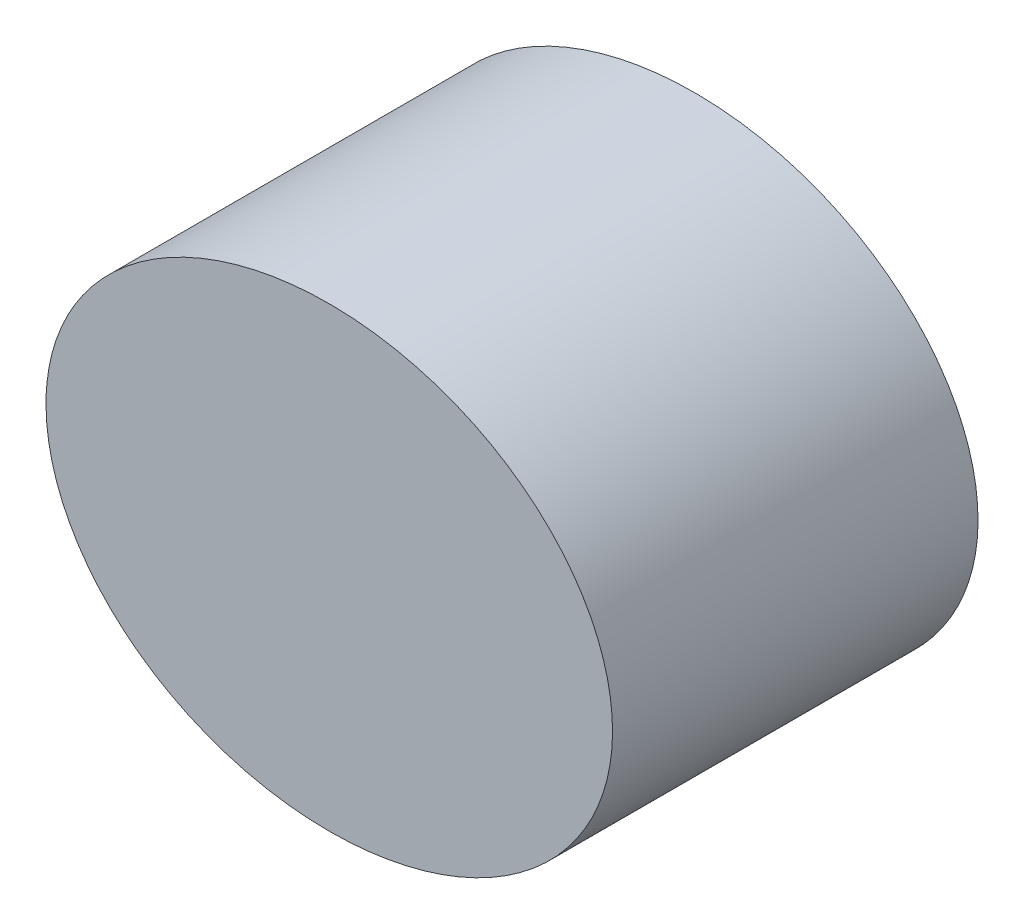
SolidWorks part; units mm, degrees
ref_plane "Front Plane" through (0, 0, 0) normal (0, 0, 1) x (1, 0, 0)
ref_plane "Top Plane" through (0, 0, 0) normal (0, 1, 0) x (1, 0, 0)
ref_plane "Right Plane" through (0, 0, 0) normal (1, 0, 0) x (0, 0, -1)
sketch "Sketch1" plane through (0, 0, 0) normal (0, 0, 1) x (1, 0, 0)
  ellipse E0 centre (0, 0) end of major axis (-15.5, 0) minor radius 12.5
ref_plane "Plane1" through (0, 0, 60) normal (0, 0, 1) x (1, 0, 0)
ref_plane "Plane2" through (0, 0, 110) normal (0, 0, 1) x (1, 0, 0)
sketch "Sketch2" plane through (0, 0, 60) normal (0, 0, 1) x (1, 0, 0)
  ellipse E0 centre (0, 0) end of major axis (-16, 0) minor radius 13
sketch "Sketch3" plane through (0, 0, 110) normal (0, 0, 1) x (1, 0, 0)
  ellipse E0 centre (0, -1.5) end of major axis (-13, -1.5) minor radius 10.5
ref_plane "Plane3" through (0, 0, 135) normal (0, 0, 1) x (1, 0, 0)
sketch "Sketch4" plane through (0, 0, 135) normal (0, 0, 1) x (1, 0, 0)
  ellipse E0 centre (0, -5) end of major axis (0, -2) minor radius 3
ref_plane "Plane4" through (0, 0, -25) normal (0, 0, 1) x (1, 0, 0)
sketch "Sketch6" plane through (0, 0, -25) normal (0, 0, 1) x (1, 0, 0)
  ellipse E0 centre (0, 0) end of major axis (-15.5, 0) minor radius 12.5
ref_plane "Plane5" through (0, 0, -110) normal (0, 0, 1) x (1, 0, 0)
sketch "Sketch7" plane through (0, 0, -110) normal (0, 0, 1) x (1, 0, 0)
  ellipse E0 centre (0, -1) end of major axis (0, 5.5) minor radius 6
sketch "Sketch8" plane through (0, 0, 0) normal (1, 0, 0) x (0, 0, -1)
  line L0 (0.1799, 7.5433) -> (-5.6164, 13.3397)
  line L1 (-5.6164, 13.3397) -> (154.903, 13.3397)
  line L2 (154.903, 13.3397) -> (154.903, 2.5176)
  spline S0 degree 3 number of poles 80 (0.1799, 7.5433) -> (154.903, 2.5176)
sketch "Sketch9" plane through (0, 0, 0) normal (0, 0, 1) x (1, 0, 0)
  line L0 (0, 0) -> (29.8357, 3.1359)
sketch "Sketch10" plane through (0, 0, 0) normal (0, 0, 1) x (1, 0, 0)
  line L0 (0, 0) -> (-29.8357, 3.1359)
sketch "Sketch11" plane through (0, 0, -110) normal (0, 0, 1) x (1, 0, 0)
  line L2 (-1, 1.4583) -> (-1, 6.991)
  line L3 (-1, 6.991) -> (1, 6.991)
  line L4 (1, 1.4583) -> (1, 6.991)
  arc A0 (-1, 1.4583) -> (1, 1.4583) centre (0, -2) ccw
extrude "Boss-Extrude1" add sketch "Sketch1" along normal blind 20
